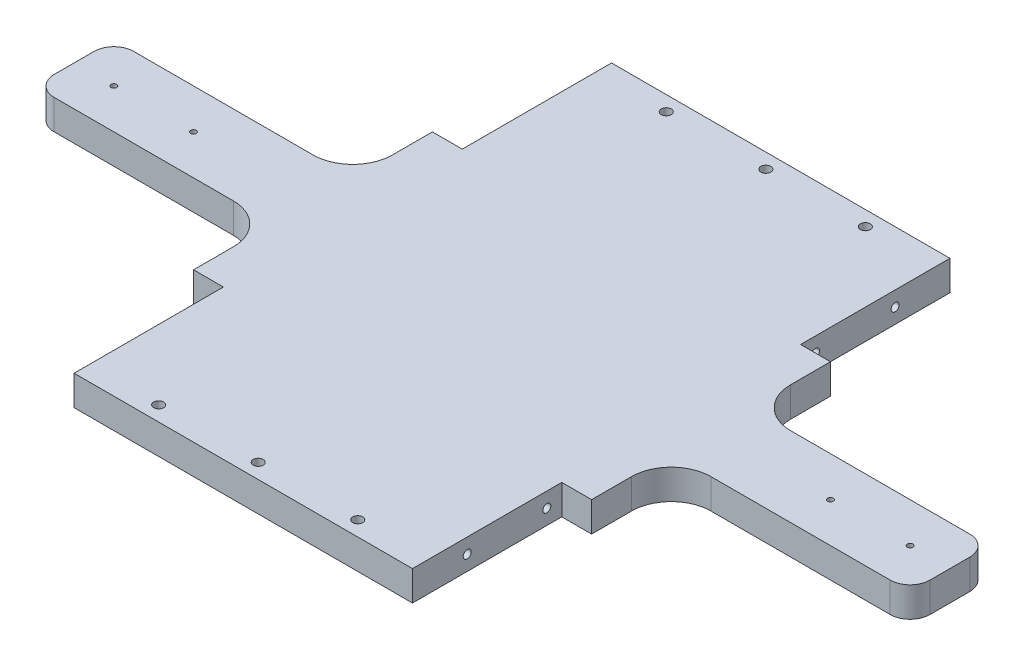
SolidWorks part; units mm, degrees
ref_plane "Front Plane" through (0, 0, 0) normal (0, 0, 1) x (1, 0, 0)
ref_plane "Top Plane" through (0, 0, 0) normal (0, 1, 0) x (1, 0, 0)
ref_plane "Right Plane" through (0, 0, 0) normal (1, 0, 0) x (0, 0, -1)
sketch "Sketch1" plane through (0, 0, 0) normal (0, 1, 0) x (1, 0, 0)
  line L0 (127, -171.45) -> (-127, -171.45)
  line L1 (127, -171.45) -> (127, 171.45)
  line L2 (-127, -171.45) -> (-127, 171.45)
  line L3 (127, 171.45) -> (-127, 171.45)
  line L4 (127, -171.45) -> (-127, 171.45) construction
  line L5 (-127, -171.45) -> (127, 171.45) construction
  line L6 (-127, 25.4) -> (-127, -25.4)
  line L7 (-127, 25.4) -> (-279.4, 25.4)
  line L8 (-127, -25.4) -> (-279.4, -25.4)
  line L9 (-279.4, 25.4) -> (-279.4, -25.4)
  line L10 (127, 25.4) -> (279.4, 25.4)
  line L11 (127, 25.4) -> (127, -25.4)
  line L12 (279.4, 25.4) -> (279.4, -25.4)
  line L13 (127, -25.4) -> (279.4, -25.4)
  point P1 (0, 0)
  dimension "D1" = 342.9
  dimension "D2" = 254
  dimension "D3" = 50.8
  dimension "D4" = 146.05
  dimension "D5" = 50.8
  dimension "D6" = 152.4
  dimension "D7" = 152.4
  dimension "D8" = 146.05
extrude "Boss-Extrude1" add sketch "Sketch1" along normal blind 19.05 contours L7 L9 L8 L2 | L1 L3 L2 L0 | L1 L13 L12 L10
sketch "Sketch2" plane through (0, 19.05, 0) normal (0, 1, 0) x (1, 0, 0)
  line L0 (-279.4, 25.4) -> (-279.4, -25.4) construction
  line L1 (279.4, 25.4) -> (279.4, -25.4) construction
  circle A0 centre (-203.2, -0.033) radius 1.778
  circle A1 centre (-254, -0.011) radius 1.778
  circle A2 centre (203.2, 0) radius 1.778
  circle A3 centre (254, 0) radius 1.778
  point P2 (-279.4, 0)
  dimension "D1" = 76.2
  dimension "D2" = 50.8
  dimension "D3" = 76.2
  dimension "D4" = 50.8
extrude "Cut-Extrude1" cut sketch "Sketch2" against normal through all
fillet "Fillet1" radius 12.7 1 edges at (-279.4, 9.525, 25.4)
fillet "Fillet2" radius 12.7 1 edges at (-279.4, 9.525, -25.4)
fillet "Fillet3" radius 12.7 1 edges at (279.4, 9.525, -25.4)
fillet "Fillet4" radius 12.7 1 edges at (279.4, 9.525, 25.4)
fillet "Fillet5" radius 25.4 1 edges at (127, 9.525, -25.4)
fillet "Fillet6" radius 25.4 1 edges at (127, 9.525, 25.4)
fillet "Fillet7" radius 25.4 1 edges at (-127, 9.525, 25.4)
fillet "Fillet8" radius 25.4 1 edges at (-127, 9.525, -25.4)
hole_wizard "1/4 (0.25) Diameter Hole1" positions "Sketch4" profile "Sketch5" hole size "1/4" standard "ANSI Inch"
sketch "Sketch4" plane through (0, 19.05, 0) normal (0, 1, 0) x (1, 0, 0)
  line L2 (127, 50.8) -> (127, 171.45) construction
  line L3 (127, 171.45) -> (-127, 171.45) construction
  point P0 (63.5, 161.925)
  dimension "D1" = 63.5
  dimension "D2" = 9.525
sketch "Sketch5" plane through (63.5, 19.05, -161.925) normal (1, 0, 0) x (0, 0, 1)
  line L0 (0, 0) -> (0, 19.05)
  line L1 (0, 19.05) -> (3.175, 19.05)
  line L2 (3.175, 19.05) -> (3.175, 0)
  line L5 (3.175, 0) -> (0, 0)
  line L11 (0, -6.35) -> (0, 107.95) construction
  dimension "Thru Hole Dia." = 6.35
  dimension "Thru Hole Depth" = 19.05
mirror "Mirror1" about plane through (0, 0, 0) normal (1, 0, 0) of "1/4 (0.25) Diameter Hole1"
hole_wizard "1/4 (0.25) Diameter Hole2" positions "Sketch7" profile "Sketch6" hole size "1/4" standard "ANSI Inch"
sketch "Sketch7" plane through (0, 19.05, 0) normal (0, 1, 0) x (1, 0, 0)
  line L0 (127, 171.45) -> (-127, 171.45) construction
  point P0 (0, 161.925)
  point P3 (0, 171.45)
  dimension "D1" = 9.525
sketch "Sketch6" plane through (0, 19.05, -161.925) normal (1, 0, 0) x (0, 0, 1)
  line L0 (0, 0) -> (0, 19.05)
  line L1 (0, 19.05) -> (3.175, 19.05)
  line L2 (3.175, 19.05) -> (3.175, 0)
  line L5 (3.175, 0) -> (0, 0)
  line L11 (0, -6.35) -> (0, 107.95) construction
  dimension "Thru Hole Dia." = 6.35
  dimension "Thru Hole Depth" = 19.05
mirror "Mirror2" about plane through (0, 0, 0) normal (0, 0, 1) of "1/4 (0.25) Diameter Hole2", "Mirror1", "1/4 (0.25) Diameter Hole1"
sketch "Sketch8" plane through (127, 0, 0) normal (1, 0, 0) x (0, 0, -1)
  line L0 (171.45, 19.05) -> (171.45, 0)
  line L1 (171.45, 19.05) -> (76.2, 19.05)
  line L2 (171.45, 0) -> (76.2, 0)
  line L3 (76.2, 19.05) -> (76.2, 0)
  dimension "D1" = 95.25
extrude "Cut-Extrude2" cut sketch "Sketch8" against normal blind 19.05
mirror "Mirror3" about plane through (0, 0, 0) normal (0, 0, 1) of "Cut-Extrude2"
mirror "Mirror4" about plane through (0, 0, 0) normal (1, 0, 0) of "Cut-Extrude2"
mirror "Mirror5" about plane through (0, 0, 0) normal (0, 0, 1) of "Mirror4"
hole_wizard "#7 (0.201) Diameter Hole1" positions "Sketch13" profile "Sketch12" hole size "#7" standard "ANSI Inch"
sketch "Sketch13" plane through (-107.95, 0, 0) normal (-1, 0, 0) x (0, 0, 1)
  line L0 (-171.45, 19.05) -> (-76.2, 19.05) construction
  line L1 (-76.2, 19.05) -> (-76.2, 0) construction
  point P0 (-85.725, 9.525)
  dimension "D1" = 9.525
  dimension "D2" = 9.525
sketch "Sketch12" plane through (-107.95, 9.525, -85.725) normal (0, 1, 0) x (0, 0, 1)
  line L0 (0, 0) -> (0, 52.3338)
  line L1 (0, 52.3338) -> (2.5527, 50.8)
  line L2 (2.5527, 50.8) -> (2.5527, 0)
  line L5 (2.5527, 0) -> (0, 0)
  line L10 (0, 52.3338) -> (-2.5527, 50.8) construction
  line L11 (0, -6.35) -> (0, 107.95) construction
  dimension "Hole Dia." = 5.1054
  dimension "Hole Depth" = 50.8
  dimension "Drill Angle" = 118
hole_wizard "#7 (0.201) Diameter Hole2" positions "Sketch15" profile "Sketch14" hole size "#7" standard "ANSI Inch"
sketch "Sketch15" plane through (-107.95, 0, 0) normal (-1, 0, 0) x (0, 0, 1)
  line L0 (-171.45, 19.05) -> (-76.2, 19.05) construction
  circle A0 centre (-85.725, 9.525) radius 2.5527 construction
  point P0 (-136.525, 9.525)
  dimension "D2" = 50.8
  dimension "D1" = 9.525
sketch "Sketch14" plane through (-107.95, 9.525, -136.525) normal (0, 1, 0) x (0, 0, 1)
  line L0 (0, 0) -> (0, 52.3338)
  line L1 (0, 52.3338) -> (2.5527, 50.8)
  line L2 (2.5527, 50.8) -> (2.5527, 0)
  line L5 (2.5527, 0) -> (0, 0)
  line L10 (0, 52.3338) -> (-2.5527, 50.8) construction
  line L11 (0, -6.35) -> (0, 107.95) construction
  dimension "Hole Dia." = 5.1054
  dimension "Hole Depth" = 50.8
  dimension "Drill Angle" = 118
mirror "Mirror6" about plane through (0, 0, 0) normal (1, 0, 0) of "#7 (0.201) Diameter Hole2", "#7 (0.201) Diameter Hole1"
mirror "Mirror7" about plane through (0, 0, 0) normal (0, 0, 1) of "Mirror6", "#7 (0.201) Diameter Hole2", "#7 (0.201) Diameter Hole1"
